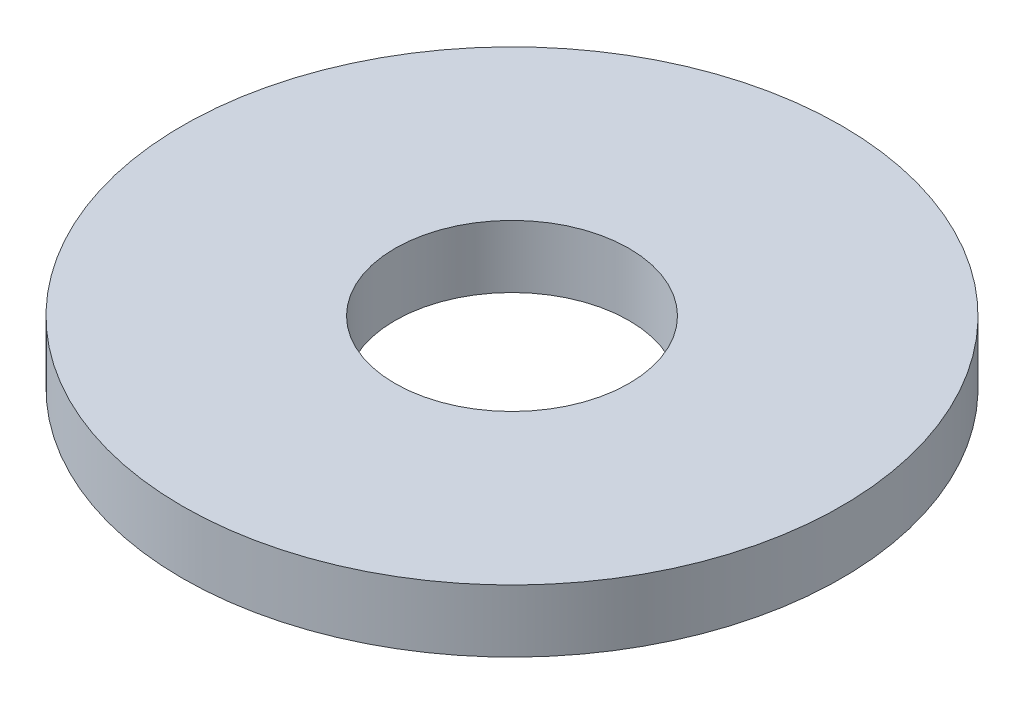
SolidWorks part; units mm, degrees
ref_plane "Front" through (0, 0, 0) normal (0, 0, 1) x (1, 0, 0)
ref_plane "Top" through (0, 0, 0) normal (0, 1, 0) x (1, 0, 0)
ref_plane "Right" through (0, 0, 0) normal (1, 0, 0) x (0, 0, -1)
sketch "Sketch1" plane through (0, 0, 0) normal (0, 1, 0) x (1, 0, 0)
  circle A0 centre (0, 0) radius 9.5123
  circle A1 centre (0, 0) radius 3.3782
  dimension "D1" = 19.0246
  dimension "D2" = 6.7564
extrude "Extrude1" add sketch "Sketch1" along normal blind 1.8034
